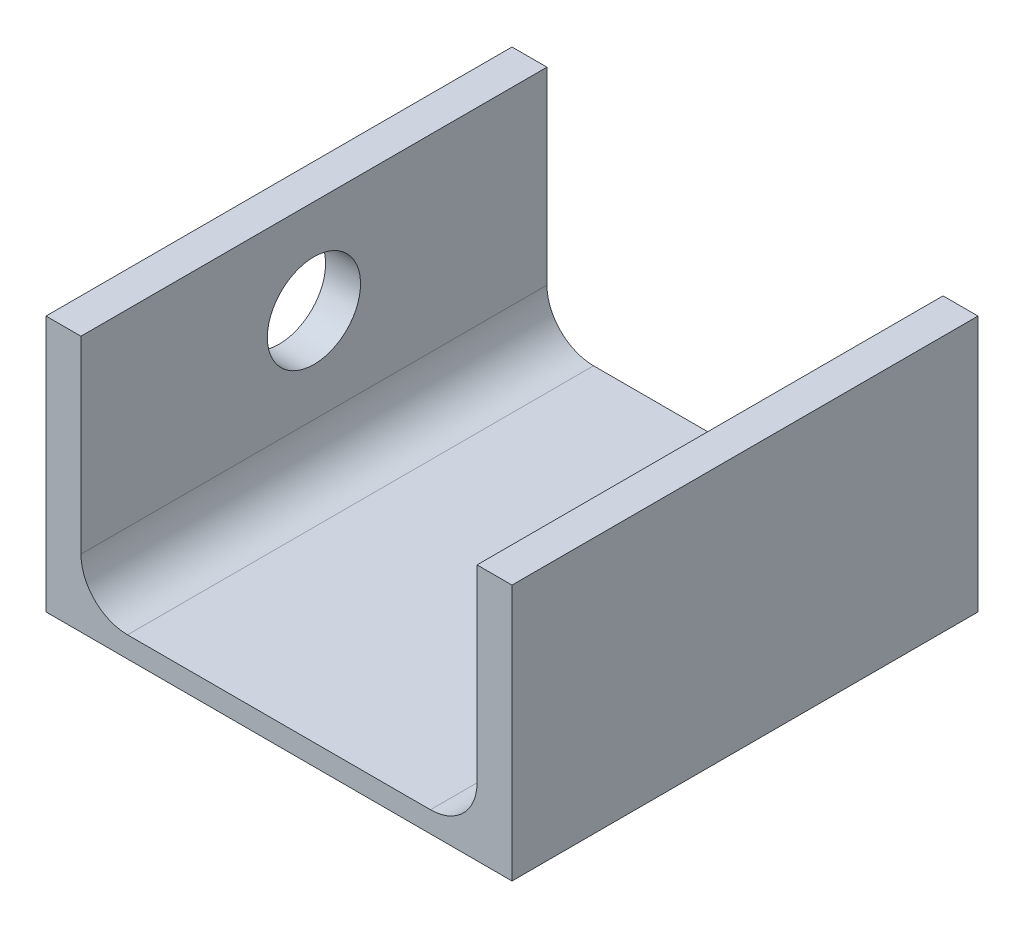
SolidWorks part; units mm, degrees
ref_plane "Plan de face" through (0, 0, 0) normal (0, 0, 1) x (1, 0, 0)
ref_plane "Plan de dessus" through (0, 0, 0) normal (0, 1, 0) x (1, 0, 0)
ref_plane "Plan de droite" through (0, 0, 0) normal (1, 0, 0) x (0, 0, -1)
sketch "Esquisse1" plane through (0, 0, 0) normal (0, 0, 1) x (1, 0, 0)
  line L0 (0, 0) -> (100, 0)
  line L1 (100, 0) -> (100, 55)
  line L2 (100, 55) -> (92.5, 55)
  line L3 (92.5, 55) -> (92.5, 14.5)
  line L4 (82.5, 4.5) -> (17.5, 4.5)
  line L5 (7.5, 14.5) -> (7.5, 55)
  line L6 (0, 0) -> (0, 55)
  line L7 (0, 55) -> (7.5, 55)
  arc A0 (17.5, 4.5) -> (7.5, 14.5) centre (17.5, 14.5) cw
  arc A1 (92.5, 14.5) -> (82.5, 4.5) centre (82.5, 14.5) cw
  dimension "D7" = 10
  dimension "D1" = 100
  dimension "D2" = 55
  dimension "D3" = 7.5
  dimension "D4" = 7.5
  dimension "D5" = 4.5
  dimension "D6" = 55
extrude "Extrusion1" add sketch "Esquisse1" along normal blind 100 contours L1 L2 L3 A1 L4 A0 L5 L7 L6 L0
sketch "Esquisse2" plane through (0, 0, 0) normal (-1, 0, 0) x (0, 0, 1)
  line L0 (100, 55) -> (0, 55) construction
  line L1 (0, 0) -> (0, 55) construction
  circle A0 centre (50, 34.75) radius 10
  dimension "D1" = 20.25
  dimension "D2" = 50
extrude "Enlèv. mat.-Extru.1" cut sketch "Esquisse2" against normal blind 10
